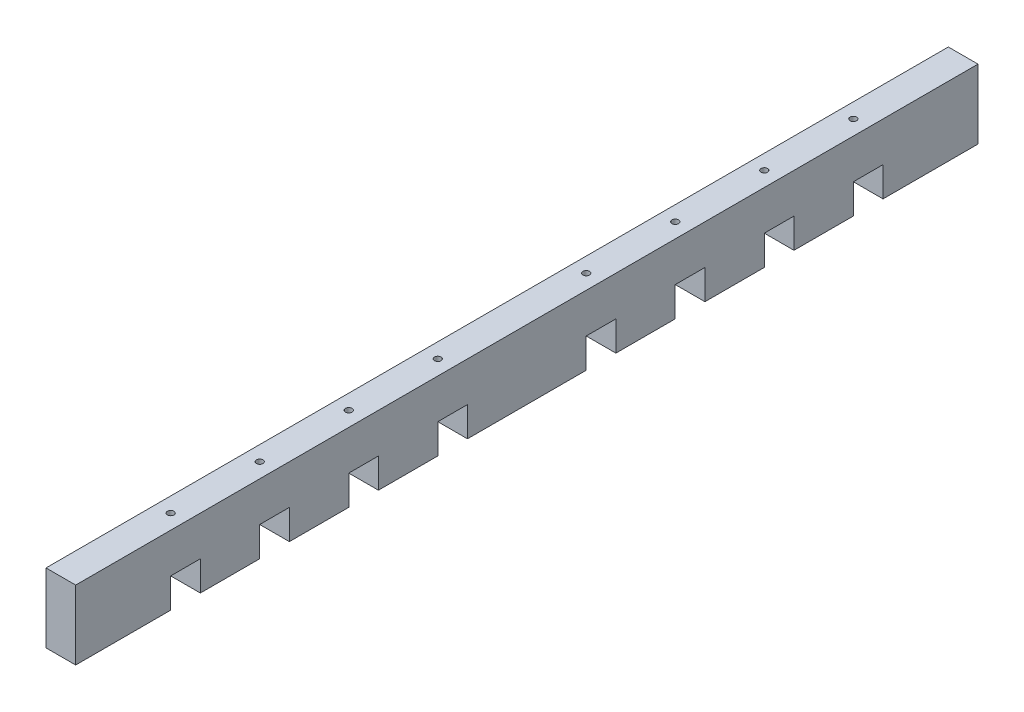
SolidWorks part; units mm, degrees
ref_plane "Plan de face" through (0, 0, 0) normal (0, 0, 1) x (1, 0, 0)
ref_plane "Plan de dessus" through (0, 0, 0) normal (0, 1, 0) x (1, 0, 0)
ref_plane "Plan de droite" through (0, 0, 0) normal (1, 0, 0) x (0, 0, -1)
sketch "Esquisse1" plane through (0, 0, 0) normal (0, 0, 1) x (1, 0, 0)
  line L1 (0, 0) -> (-15, 0)
  line L2 (0, 0) -> (0, 35)
  line L3 (0, 35) -> (-15, 35)
  line L4 (-15, 0) -> (-15, 35)
  dimension "D1" = 15
  dimension "D2" = 35
extrude "Boss.-Extru.1" add sketch "Esquisse1" along normal mid plane 456
sketch "Esquisse2" plane through (0, 0, 0) normal (1, 0, 0) x (0, 0, -1)
  line L0 (-228, 0) -> (228, 0) construction
  line L1 (-30, 0) -> (-45, 0)
  line L2 (-30, 0) -> (-30, 15)
  line L3 (-30, 15) -> (-45, 15)
  line L4 (-45, 0) -> (-45, 15)
  dimension "D1" = 15
  dimension "D2" = 15
  dimension "D3" = 30
extrude "Enlèv. mat.-Extru.1" cut sketch "Esquisse2" against normal through all
hole_wizard "Trou taraudé M41" positions "Esquisse4" profile "Esquisse3" tap size "M4" standard "ISO"
sketch "Esquisse4" plane through (0, 15, 0) normal (0, -1, 0) x (1, 0, 0)
  line L0 (-15, 30) -> (0, 30) construction
  line L1 (-15, 30) -> (-15, 45) construction
  point P0 (-7.5, 37.5)
  dimension "D1" = 7.5
  dimension "D2" = 7.5
sketch "Esquisse3" plane through (-7.5, 15, 37.5) normal (1, 0, 0) x (0, 0, -1)
  line L0 (0, 0) -> (0, 20)
  line L1 (0, 20) -> (1.65, 20)
  line L2 (1.65, 20) -> (1.65, 0)
  line L5 (1.65, 0) -> (0, 0)
  line L11 (0, -6.35) -> (0, 107.95) construction
  dimension "Diamètre du trou pour taraudage jusqu'au prochain" = 3.3
  dimension "Profondeur du trou pour taraudage jusqu'au prochain" = 20
pattern_linear "Répétition linéaire1" count 4 spacing 45 along (0, 0, 1) of "Enlèv. mat.-Extru.1", "Trou taraudé M41"
mirror "Symétrie1" about plane through (0, 0, 0) normal (0, 0, 1) of "Répétition linéaire1", "Enlèv. mat.-Extru.1", "Trou taraudé M41"
